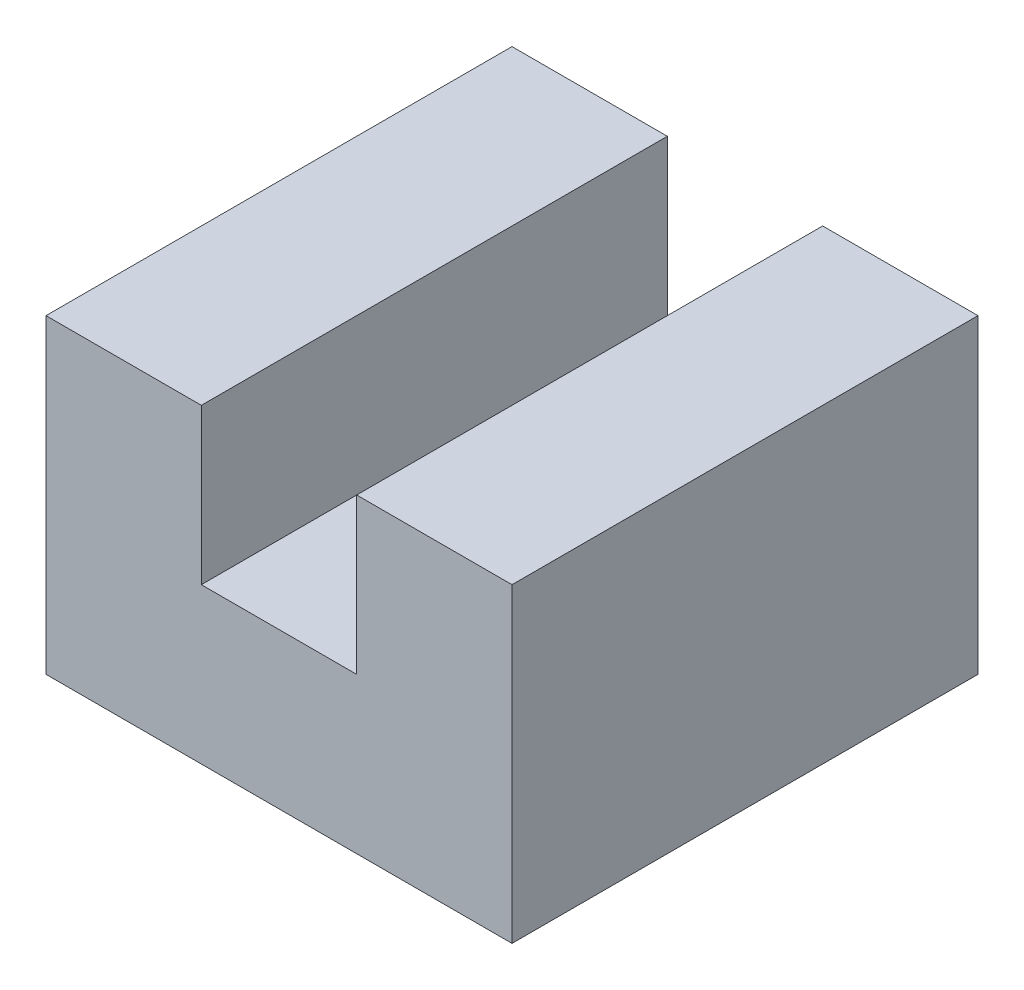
SolidWorks part; units mm, degrees
ref_plane "正面" through (0, 0, 0) normal (0, 0, 1) x (1, 0, 0)
ref_plane "平面" through (0, 0, 0) normal (0, 1, 0) x (1, 0, 0)
ref_plane "右側面" through (0, 0, 0) normal (1, 0, 0) x (0, 0, -1)
sketch "ｽｹｯﾁ1" plane through (0, 0, 0) normal (0, 0, 1) x (1, 0, 0)
  line L0 (0, 0) -> (0, 40)
  line L1 (0, 40) -> (20, 40)
  line L2 (20, 40) -> (20, 20)
  line L3 (20, 20) -> (40, 20)
  line L4 (40, 20) -> (40, 40)
  line L5 (40, 40) -> (60, 40)
  line L6 (60, 40) -> (60, 0)
  line L7 (60, 0) -> (0, 0)
  dimension "D1" = 20
  dimension "D2" = 40
  dimension "D3" = 40
  dimension "D4" = 60
  dimension "D5" = 20
  dimension "D6" = 20
extrude "押し出し1" add sketch "ｽｹｯﾁ1" along normal blind 60
sketch "ｽｹｯﾁ2" plane through (0, 0, 0) normal (0, -1, 0) x (1, 0, 0)
  line L0 (0, 60) -> (0, 0) construction
  line L2 (0, 0) -> (60, 0) construction
  circle A0 centre (30, 30) radius 10
  dimension "D1" = 20
  dimension "D2" = 30
  dimension "D3" = 30
extrude "押し出し2" cut sketch "ｽｹｯﾁ2" against normal blind 15
